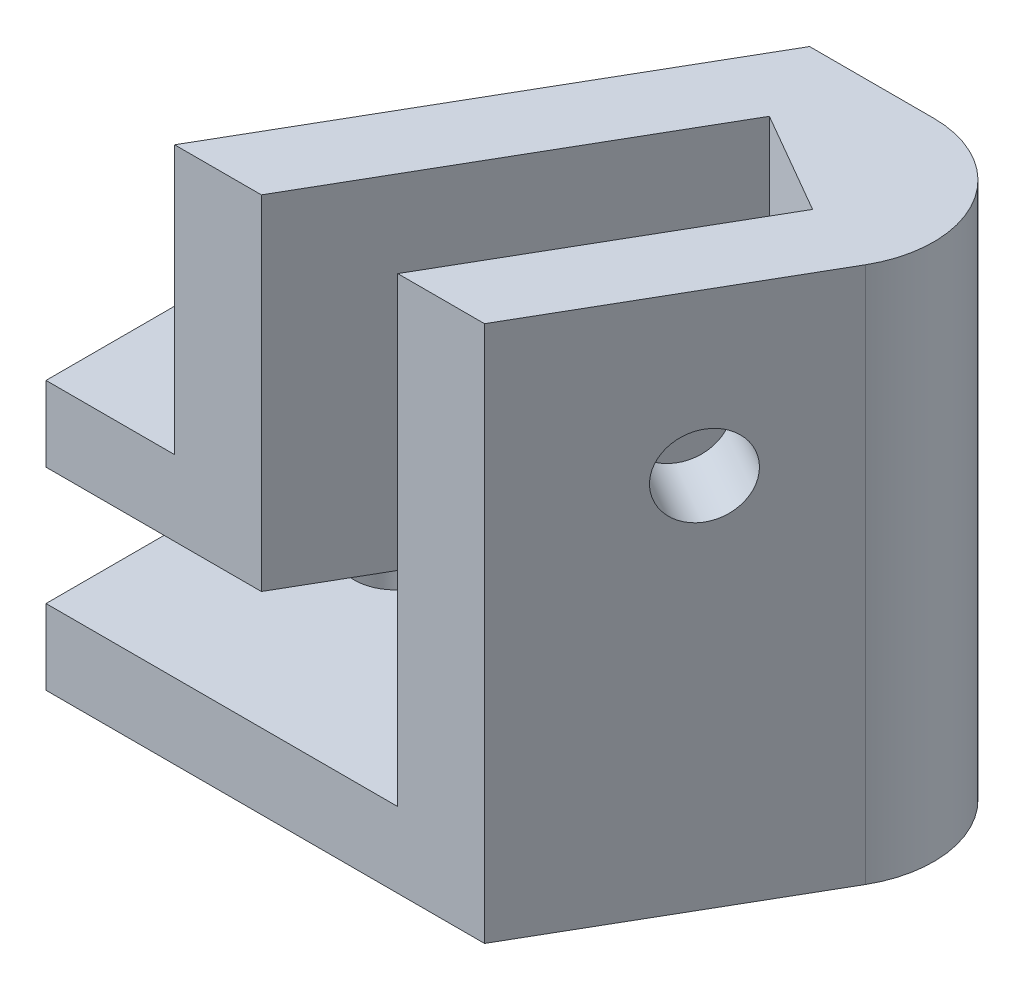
SolidWorks part; units mm, degrees
ref_plane "前视基准面" through (0, 0, 0) normal (0, 0, 1) x (1, 0, 0)
ref_plane "上视基准面" through (0, 0, 0) normal (0, 1, 0) x (1, 0, 0)
ref_plane "右视基准面" through (0, 0, 0) normal (1, 0, 0) x (0, 0, -1)
sketch "草图1" plane through (0, 0, 0) normal (0, 1, 0) x (1, 0, 0)
  line L1 (-12.5, -7.5) -> (12.5, -7.5)
  line L2 (-12.5, -7.5) -> (-12.5, 7.5)
  line L3 (-12.5, 7.5) -> (12.5, 7.5)
  line L4 (12.5, -7.5) -> (12.5, 7.5)
  line L5 (-12.5, -7.5) -> (12.5, 7.5) construction
  line L6 (-12.5, 7.5) -> (12.5, -7.5) construction
  point P0 (0, 0)
  dimension "D1" = 25
  dimension "D2" = 15
extrude "凸台-拉伸1" add sketch "草图1" along normal blind 10
sketch "草图2" plane through (0, 10, 0) normal (0, 1, 0) x (1, 0, 0)
  line L0 (0.953, 7.5) -> (-7.7073, -7.5)
  line L1 (12.5, 7.5) -> (-12.5, 7.5) construction
  line L2 (-12.5, -7.5) -> (12.5, -7.5) construction
  line L3 (12.5, 7.5) -> (3.8397, -7.5)
  line L4 (12.5, -7.5) -> (12.5, 7.5) construction
  line L5 (0.953, 7.5) -> (12.5, 7.5)
  line L6 (3.8397, -7.5) -> (-7.7073, -7.5)
  dimension "D1" = 10
  dimension "D2" = 30
extrude "凸台-拉伸2" add sketch "草图2" along normal blind 10
sketch "草图3" plane through (0, 10, 0) normal (0, 1, 0) x (1, 0, 0)
  line L3 (12.5, 7.5) -> (3.8397, -7.5)
  line L4 (3.8397, -7.5) -> (12.5, -7.5)
  line L5 (12.5, -7.5) -> (12.5, 7.5)
  line L6 (12.5, 7.5) -> (3.8397, -7.5)
  line L7 (3.8397, -7.5) -> (12.5, -7.5)
  line L8 (12.5, -7.5) -> (12.5, 7.5)
  dimension "D1" = 0
extrude "切除-拉伸1" cut sketch "草图3" against normal blind 15
sketch "草图4" plane through (0, 20, 0) normal (0, 1, 0) x (1, 0, 0)
  line L0 (-1.9338, -7.5) -> (5.6295, 5.6) construction
  line L1 (-7.7073, -7.5) -> (3.8397, -7.5) construction
  line L2 (-4.9735, -8.3649) -> (2.4541, 4.5)
  line L3 (-0.0285, -8.6) -> (7.5348, 4.5)
  line L4 (-3.839, -6.4) -> (3.7243, 6.7) construction
  line L5 (-4.9735, -8.3649) -> (-0.0285, -8.6)
  line L6 (7.5348, 4.5) -> (2.4541, 4.5)
  dimension "D1" = 60
  dimension "D4" = 12
  dimension "D2" = 2.2
  dimension "D3" = 2.2
extrude "切除-拉伸2" cut sketch "草图4" against normal blind 17
sketch "草图5" plane through (-12.5, 0, 0) normal (-1, 0, 0) x (0, 0, 1)
  line L0 (7.5, 5) -> (-4.5, 5) construction
  line L1 (7.5, 10) -> (7.5, 0) construction
  line L2 (7.5, 7.2) -> (-4.5, 7.2)
  line L3 (7.5, 2.8) -> (-4.5, 2.8)
  line L4 (-4.5, 7.2) -> (-4.5, 2.8)
  line L5 (7.5, 2.8) -> (7.5, 7.2)
  dimension "D1" = 12
  dimension "D2" = 2.2
  dimension "D3" = 2.2
extrude "切除-拉伸3" cut sketch "草图5" against normal up to surface (20.0348 mm away)
sketch "草图6" plane through (0, 20, 0) normal (0, 1, 0) x (1, 0, 0)
  line L0 (2.4541, 4.5) -> (6.2646, 2.3)
  line L1 (7.5348, 4.5) -> (0.6066, -7.5) construction
  line L2 (6.2646, 2.3) -> (7.5348, 4.5)
  line L3 (7.5348, 4.5) -> (2.4541, 4.5)
extrude "凸台-拉伸3" add sketch "草图6" against normal up to surface (12.8 mm away)
fillet "圆角1" radius 4 1 edges at (12.5, 10, -7.5)
extrude "切除-拉伸10" cut sketch "草图13" against normal blind 20
sketch "草图13" plane through (-85.6696, 0, 130.5) normal (0, -1, 0) x (-1, 0, 0)
  line L2 (24.2864, 135) -> (24.2864, 120.1246) construction
  circle A0 centre (-78.1696, 131) radius 1.5
  circle A1 centre (126.7423, 131) radius 1.5
extrude "切除-拉伸11" cut sketch "草图14" against normal blind 20
sketch "草图14" plane through (-71.7982, 77.3989, 138.5087) normal (0.866, 0, 0.5) x (0, -1, 0)
  line L1 (-3.8989, 161.1181) -> (-3.8989, 143.2827) construction
  circle A0 centre (-71.3989, 157.2758) radius 1.5
  circle A1 centre (63.3989, 157.2758) radius 1.5
